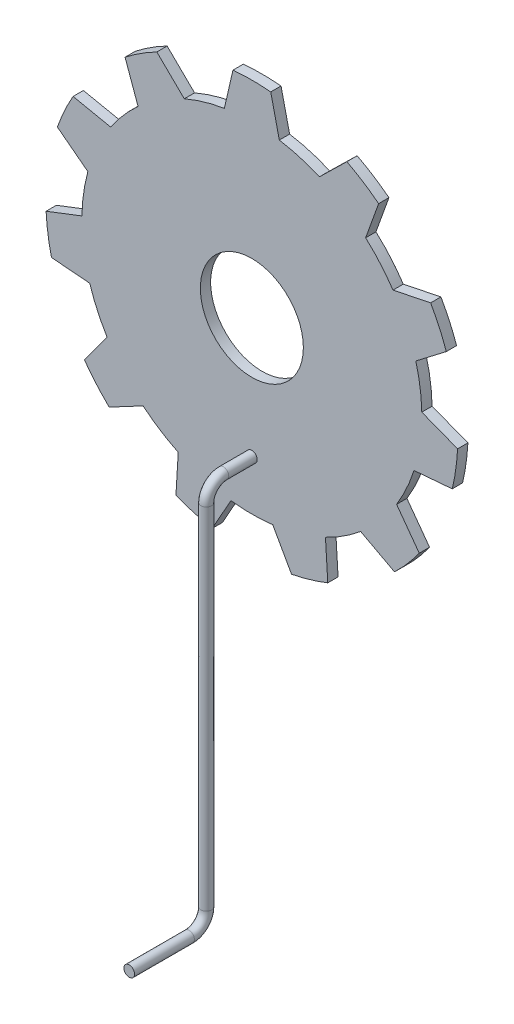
SolidWorks part; units mm, degrees
ref_plane "Front" through (0, 0, 0) normal (0, 0, 1) x (1, 0, 0)
ref_plane "Top" through (0, 0, 0) normal (0, 1, 0) x (1, 0, 0)
ref_plane "Right" through (0, 0, 0) normal (1, 0, 0) x (0, 0, -1)
sketch "Sketch1" plane through (0, 0, 0) normal (0, 0, 1) x (1, 0, 0)
  circle A0 centre (0, 0) radius 49.4999
extrude "Base-Extrude" add sketch "Sketch1" along normal blind 3
sketch "Sketch2" plane through (0, 0, 3) normal (0, 0, 1) x (1, 0, 0)
  line L0 (-8, 48.8492) -> (-5.5, 59.7474)
  line L1 (8, 48.8492) -> (5.5, 59.7474)
  line L2 (0, 0) -> (0, 29.3705) construction
  arc A0 (5.5, 59.7474) -> (-5.5, 59.7474) centre (0, 0) ccw
  circle A1 centre (0, 0) radius 49.4999
  arc A2 (8, 48.8492) -> (-8, 48.8492) centre (0, 0) ccw
  dimension "D2" = 60
  dimension "D3" = 16
  dimension "D4" = 11
  dimension "D1" = 0
extrude "Boss-Extrude2" add sketch "Sketch2" against normal through all
pattern_circular "CirPattern3" count 11 over 360 about axis through (0, 0, 0) along (0, 0, 1) of "Boss-Extrude2"
sketch "Sketch9" plane through (0, 0, 3) normal (0, 0, 1) x (1, 0, 0)
  circle A0 centre (0, 0) radius 15
  dimension "D2" = 30
extrude "Cut-Extrude2" cut sketch "Sketch9" against normal blind 733
sketch "Sketch10" plane through (0, 0, 0) normal (1, 0, 0) x (0, 0, -1)
  line L0 (0, -34.9696) -> (-11.2842, -34.9696)
  line L1 (-16.2842, -39.9696) -> (-16.2842, -141.889)
  line L2 (-21.2842, -146.889) -> (-38.7104, -146.889)
  arc A0 (-11.2842, -34.9696) -> (-16.2842, -39.9696) centre (-11.2842, -39.9696) ccw
  arc A1 (-16.2842, -141.889) -> (-21.2842, -146.889) centre (-21.2842, -141.889) cw
  dimension "D1" = 5
sketch "Sketch11" plane through (0, 0, 0) normal (0, 0, -1) x (-1, 0, 0)
  circle A0 centre (0, -34.9696) radius 1.5608
sweep "Boss-Sweep1" add profiles "Sketch11" path "Sketch10"
